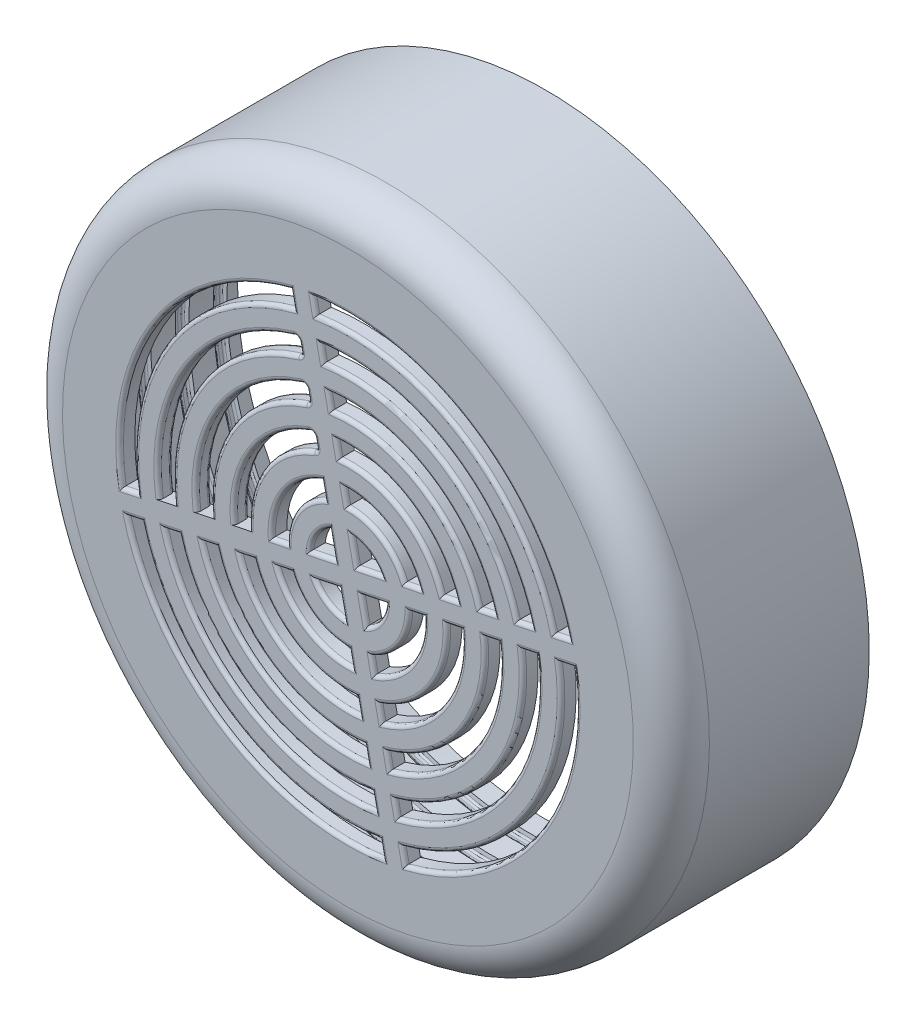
SolidWorks part; units mm, degrees
ref_plane "Front Plane" through (0, 0, 0) normal (0, 0, 1) x (1, 0, 0)
ref_plane "Top Plane" through (0, 0, 0) normal (0, 1, 0) x (1, 0, 0)
ref_plane "Right Plane" through (0, 0, 0) normal (1, 0, 0) x (0, 0, -1)
imported_body "top-1-solid1"
imported_body "lid-1-solid1"
combine bodies "Combine1" operation type subtract main body 102 bodies to subtract 101
fillet "Fillet2" radius 0.5 104 edges at (-22.5961, -5.9518, 52.125) (-21.7912, -7.8639, 52.125) (-20.5216, -5.9316, 52.125) (-21.6843, -0.313, 52.125) (-26.7747, -3.2061, 52.125) (-27.4098, -9.0266, 52.125) (-25.1033, -4.3043, 52.125) (-30.9534, -0.4604, 52.125) (-29.2819, -1.5586, 52.125) (-22.707, 4.6288, 52.125) (-35.132, 2.2853, 52.125) (-33.4606, 1.1871, 52.125) (-23.7246, 9.5461, 52.125) (-39.3107, 5.031, 52.125) (-37.6392, 3.9328, 52.125) (-24.7404, 14.4546, 52.125) (-25.7553, 19.3588, 52.125) (-43.4893, 7.7767, 52.125) (-47.0816, -13.0976, 52.125) (-41.8179, 6.6785, 52.125) (-46.4737, -16.0353, 52.125) (-34.8916, -33.7694, 52.125) (-14.0173, -37.3617, 52.125) (-33.7933, -32.0979, 52.125) (-32.1459, -29.5907, 52.125) (-15.0322, -32.4574, 52.125) (-31.0476, -27.9193, 52.125) (-41.5694, -15.0204, 52.125) (-29.2819, -1.5586, 50.125) (-30.9534, -0.4604, 50.125) (-29.4002, -25.4121, 52.125) (-16.048, -27.549, 52.125) (-28.3019, -23.7406, 52.125) (-36.661, -14.0046, 52.125) (-22.707, 4.6288, 50.125) (-22.9108, 5.6137, 51.125) (-22.5031, 3.6438, 51.125) (-23.9088, -17.0548, 52.125) (-18.0883, -17.6898, 52.125) (-22.8105, -15.3833, 52.125) (-26.8018, -11.9643, 52.125) (-26.6545, -21.2334, 52.125) (-17.0656, -22.6316, 52.125) (-25.5562, -19.5619, 52.125) (-31.7436, -12.987, 52.125) (-4.4832, -7.3456, 52.125) (-7.5529, -15.8363, 52.125) (-14.1278, -22.0237, 52.125) (-5.8815, -16.9345, 52.125) (-15.1505, -17.0819, 52.125) (-10.0601, -14.1888, 52.125) (-9.425, -8.3683, 52.125) (-11.7316, -13.0906, 52.125) (-10.033, -5.4306, 52.125) (-12.926, -0.3401, 52.125) (-18.7465, 0.2949, 52.125) (-14.0243, -2.0116, 52.125) (-15.6717, -4.5188, 52.125) (-17.5838, -5.3237, 52.125) (-15.6516, -6.5933, 52.125) (-15.0436, -9.531, 52.125) (-16.3133, -11.4633, 52.125) (-14.2388, -11.4431, 52.125) (-21.1832, -10.8016, 52.125) (-21.1631, -12.8761, 52.125) (-19.251, -12.0712, 52.125) (-33.4606, 1.1871, 50.125) (-35.132, 2.2853, 50.125) (-37.6392, 3.9328, 50.125) (-39.3107, 5.031, 50.125) (9.6388, -1.3596, 52.125) (-1.9432, 16.3745, 52.125) (-22.8175, 19.9668, 52.125) (-3.0415, 14.703, 52.125) (4.7346, -2.3745, 52.125) (-4.6889, 12.1958, 52.125) (-21.8026, 15.0625, 52.125) (-5.7872, 10.5244, 52.125) (-0.1739, -3.3903, 52.125) (-7.4346, 8.0172, 52.125) (-20.7868, 10.1541, 52.125) (-8.5329, 6.3457, 52.125) (-5.0912, -4.4079, 52.125) (-10.1803, 3.8385, 52.125) (-19.7692, 5.2367, 52.125) (-11.2786, 2.167, 52.125) (-11.0796, -36.7537, 52.125) (6.6545, -25.1716, 52.125) (10.2468, -4.2973, 52.125) (4.983, -24.0734, 52.125) (-12.0945, -31.8495, 52.125) (2.4759, -22.4259, 52.125) (5.3426, -5.3122, 52.125) (0.8044, -21.3277, 52.125) (0.4341, -6.328, 52.125) (-3.3743, -18.582, 52.125) (-13.1102, -26.941, 52.125) (-1.7028, -19.6802, 52.125) (-23.7246, 9.5461, 50.125) (-23.9279, 10.5284, 51.125) (-23.5213, 8.5638, 51.125) (-24.7404, 14.4546, 50.125) (-24.9434, 15.4357, 51.125) (-24.5373, 13.4734, 51.125)
